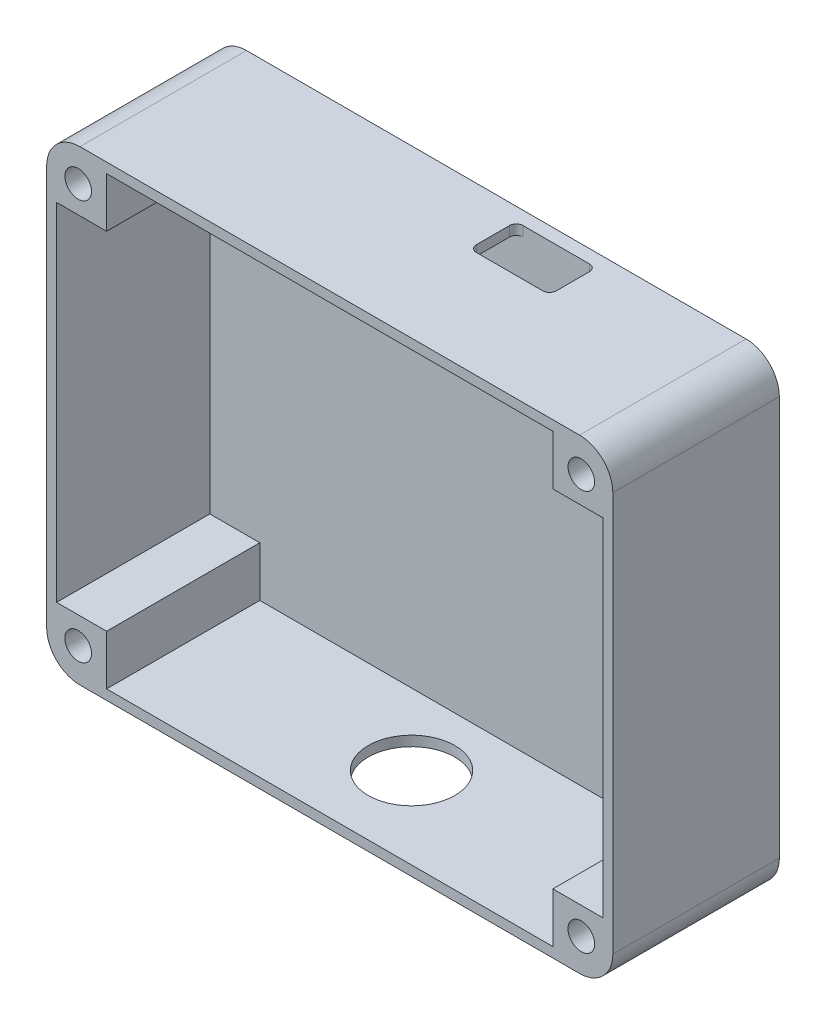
SolidWorks part; units mm, degrees
ref_plane "Front Plane" through (0, 0, 0) normal (0, 0, 1) x (1, 0, 0)
ref_plane "Top Plane" through (0, 0, 0) normal (0, 1, 0) x (1, 0, 0)
ref_plane "Right Plane" through (0, 0, 0) normal (1, 0, 0) x (0, 0, -1)
sketch "Sketch1" plane through (0, 0, 0) normal (0, 0, 1) x (1, 0, 0)
  line L1 (-37.5, 35) -> (37.5, 35)
  line L2 (-42.5, 30) -> (-42.5, -30)
  line L3 (-37.5, -35) -> (37.5, -35)
  line L4 (42.5, 30) -> (42.5, -30)
  line L5 (-42.5, 35) -> (42.5, -35) construction
  line L6 (-42.5, -35) -> (42.5, 35) construction
  arc A0 (42.5, 30) -> (37.5, 35) centre (37.5, 30) ccw
  arc A1 (42.5, -30) -> (37.5, -35) centre (37.5, -30) cw
  arc A2 (-37.5, -35) -> (-42.5, -30) centre (-37.5, -30) cw
  arc A3 (-42.5, 30) -> (-37.5, 35) centre (-37.5, 30) cw
  point P0 (0, 0)
  dimension "D3" = 5
  dimension "D1" = 85
  dimension "D2" = 70
extrude "Boss-Extrude1" add sketch "Sketch1" along normal blind 25
sketch "Sketch2" plane through (0, 0, 25) normal (0, 0, 1) x (1, 0, 0)
  line L0 (0, 37.2728) -> (0, 33.5) construction
  line L1 (-36, 33.5) -> (36, 33.5)
  line L2 (-41, 28.5) -> (-41, -28.5)
  line L3 (-36, -33.5) -> (36, -33.5)
  line L4 (41, 28.5) -> (41, -28.5)
  line L7 (-58.1674, 0) -> (59.4578, 0) construction
  line L8 (-33.5, 45.3138) -> (-33.5, 26) construction
  line L10 (-42.5, 30) -> (-42.5, -30) construction
  line L11 (-64.1535, 26) -> (-33.5, 26) construction
  line L12 (37.5, 35) -> (-37.5, 35) construction
  line L13 (-33.5, 33.5) -> (-33.5, 26)
  line L14 (-33.5, 26) -> (-41, 26)
  line L15 (33.5, 26) -> (41, 26)
  line L16 (33.5, 33.5) -> (33.5, 26)
  line L17 (33.5, -33.5) -> (33.5, -26)
  line L18 (33.5, -26) -> (41, -26)
  line L19 (-33.5, -33.5) -> (-33.5, -26)
  line L20 (-33.5, -26) -> (-41, -26)
  line L21 (-33.5, -26) -> (-33.5, -43.0713) construction
  line L23 (33.5, 26) -> (41, 26) construction
  line L24 (0, -33.5) -> (0, -39.3573) construction
  arc A0 (41, -28.5) -> (36, -33.5) centre (36, -28.5) cw
  arc A1 (41, 28.5) -> (36, 33.5) centre (36, 28.5) ccw
  arc A2 (-36, -33.5) -> (-41, -28.5) centre (-36, -28.5) cw
  arc A3 (-41, 28.5) -> (-36, 33.5) centre (-36, 28.5) cw
  point P0 (0, 0)
  dimension "D3" = 5
  dimension "D4" = 9
  dimension "D5" = 9
extrude "Cut-Extrude1" cut sketch "Sketch2" against normal blind 23 contours L20 L19 L3 L17 L18 L4 L15 L16 L1 L13 L14 L2
sketch "Sketch3" plane through (0, 0, 25) normal (0, 0, 1) x (1, 0, 0)
  line L0 (0, 48.0408) -> (0, -42.0005) construction
  line L1 (-51.8873, 0) -> (53.864, 0) construction
  circle A0 centre (-37.768, 30.0366) radius 2
  circle A1 centre (37.768, 30.0366) radius 2
  circle A2 centre (37.768, -30.0366) radius 2
  circle A3 centre (-37.768, -30.0366) radius 2
  dimension "D1" = 4
  dimension "D2" = 4
  dimension "D3" = 4
  dimension "D4" = 4
extrude "Cut-Extrude2" cut sketch "Sketch3" against normal blind 23
sketch "Sketch4" plane through (0, 35, 0) normal (0, 1, 0) x (1, 0, 0)
  line L0 (0, 14.7926) -> (0, -33.2668) construction
  line L1 (37.5, 0) -> (-37.5, 0) construction
  line L8 (6, -2) -> (16, -2)
  line L9 (5, -3) -> (5, -8)
  line L10 (6, -9) -> (16, -9)
  line L11 (17, -3) -> (17, -8)
  arc A0 (16, -9) -> (17, -8) centre (16, -8) ccw
  arc A1 (17, -3) -> (16, -2) centre (16, -3) ccw
  arc A2 (6, -9) -> (5, -8) centre (6, -8) cw
  arc A3 (5, -3) -> (6, -2) centre (6, -3) cw
  point P3 (0, -8.2127)
  point P8 (10.5, -5)
  point P15 (17, -2)
  point P18 (5, -9)
  point P21 (5, -2)
  dimension "D1" = 1
  dimension "D2" = 12
  dimension "D3" = 7
  dimension "D5" = 2
extrude "Cut-Extrude4" cut sketch "Sketch4" against normal blind 4
sketch "Sketch5" plane through (0, -35, 0) normal (0, -1, 0) x (1, 0, 0)
  line L0 (0, 32.3733) -> (0, -23.8823) construction
  line L1 (-37.5, 0) -> (37.5, 0) construction
  circle A0 centre (0, 12.7211) radius 6.5
  dimension "D1" = 13
  dimension "D2" = 12.7211
extrude "Cut-Extrude5" cut sketch "Sketch5" against normal blind 4
